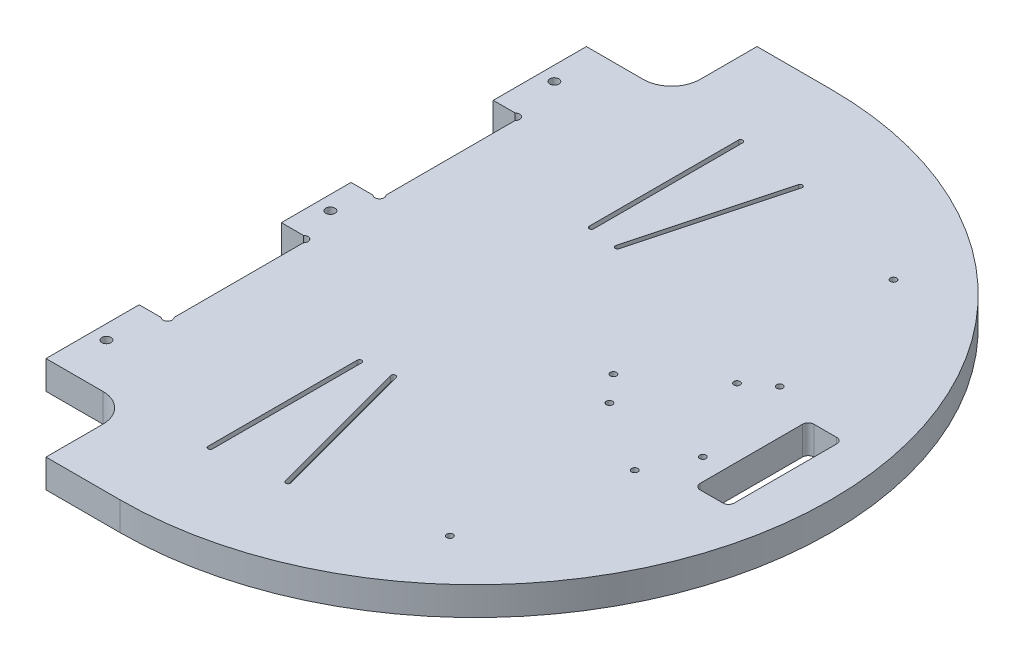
SolidWorks part; units mm, degrees
ref_plane "Plan de face" through (0, 0, 0) normal (0, 0, 1) x (1, 0, 0)
ref_plane "Plan de dessus" through (0, 0, 0) normal (0, 1, 0) x (1, 0, 0)
ref_plane "Plan de droite" through (0, 0, 0) normal (1, 0, 0) x (0, 0, -1)
sketch "Esquisse1" plane through (0, 0, 0) normal (0, 1, 0) x (1, 0, 0)
  line L0 (-177.9243, 0) -> (224.6136, 0) construction
  line L1 (0, -128.8397) -> (0, 232.2214) construction
  line L2 (-50, 153.4637) -> (-50, 78.8772) construction
  line L3 (-145, 153.4637) -> (-145, -16.1078) construction
  line L4 (-296.5055, -95) -> (138.0842, -95) construction
  line L5 (-296.5055, 95) -> (153.3586, 95) construction
  line L6 (-27.4378, -125) -> (224.6136, -125) construction
  line L7 (-16.4403, 125) -> (224.6136, 125) construction
  line L8 (50, 171.1415) -> (50, -128.8397) construction
  line L9 (145, 153.4637) -> (145, -16.1078) construction
  line L10 (175, 232.2214) -> (175, -16.1078) construction
  line L11 (24, 131.9546) -> (24, 83.7993) construction
  line L12 (-6, -128.8397) -> (-6, 131.9546) construction
  line L13 (4, 131.9546) -> (4, -110.0265) construction
  line L14 (50, 125) -> (24, 125)
  line L15 (-26, 125) -> (-26, 78.8772) construction
  line L16 (160, 48.2941) -> (160, -23.8465) construction
  line L17 (153, 31.3701) -> (153, -31.7101) construction
  line L18 (128.5, 48.2941) -> (128.5, -50.6855) construction
  line L19 (24, 125) -> (24, 105)
  line L20 (103.876, -28.5) -> (186.1026, -28.5) construction
  line L21 (103.876, 28.5) -> (186.1026, 28.5) construction
  line L22 (14, 30) -> (84.1937, 30) construction
  line L23 (-6, 95) -> (14, 95)
  line L24 (-1, 101.3704) -> (-1, -104.4655) construction
  line L25 (14, -30) -> (84.1937, -30) construction
  line L26 (-6, -95) -> (14, -95)
  line L27 (75, -37.25) -> (75, 59.9873) construction
  line L28 (25, 59.9873) -> (25, -37.25) construction
  line L29 (123, 22.0863) -> (123, -4.7308) construction
  line L32 (24, -125) -> (24, -105)
  line L38 (50, -125) -> (24, -125)
  line L39 (-6, 95) -> (-6, 62.25)
  line L40 (-9.0687, 78.75) -> (10.6589, 78.75) construction
  line L41 (-10.7326, -12.25) -> (8.3754, -12.25) construction
  line L42 (-9.8227, -37.25) -> (8.3754, -37.25) construction
  line L43 (4, -12.25) -> (-10.9186, -27.1686) construction
  line L44 (1.7373, 12.25) -> (-6, 12.25)
  line L45 (1.7373, 62.25) -> (-6, 62.25)
  line L46 (1.7373, -12.25) -> (-6, -12.25)
  line L47 (4, 59.9873) -> (4, 14.5127)
  line L48 (1.7373, -62.25) -> (-6, -62.25)
  line L49 (4, -14.5127) -> (4, -59.9873)
  line L50 (-6, 12.25) -> (-6, -12.25)
  line L51 (-6, -62.25) -> (-6, -95)
  line L53 (153, 28.5) -> (176.7692, 4.7308) construction
  line L54 (153, -28.5) -> (176.7692, -4.7308) construction
  line L55 (147, 24.6286) -> (147, -36.4853) construction
  line L56 (159, 24.6286) -> (159, -36.4891) construction
  line L57 (135.3648, -20) -> (161.0372, -20) construction
  line L58 (135.3648, 20) -> (161.0372, 20) construction
  line L60 (149, 20) -> (157, 20)
  line L61 (147, 18) -> (147, -18)
  line L62 (149, -20) -> (157, -20)
  line L63 (159, 18) -> (159, -18)
  arc A0 (50, -125) -> (50, 125) centre (50, 0) ccw construction
  circle A1 centre (50, 0) radius 40 construction
  arc A2 (50, -95) -> (50, 95) centre (50, 0) ccw construction
  arc A3 (-50, 95) -> (-50, -95) centre (-50, 0) ccw construction
  circle A4 centre (123, 0) radius 15.7 construction
  arc A5 (50, -125) -> (50, 125) centre (50, 0) ccw
  arc A6 (24, 105) -> (14, 95) centre (14, 105) cw
  circle A7 centre (123, 0) radius 19 construction
  circle A8 centre (123, 0) radius 22.5 construction
  circle A9 centre (123, 18.9498) radius 1.1
  arc A10 (24, -105) -> (14, -95) centre (14, -105) ccw
  arc A11 (4, -14.5127) -> (1.7373, -12.25) centre (2.8686, -13.3814) ccw
  circle A12 centre (139.411, -9.4749) radius 1.1
  arc A13 (149, 20) -> (147, 18) centre (149, 18) ccw
  arc A14 (4, -59.9873) -> (1.7373, -62.25) centre (2.8686, -61.1186) cw
  arc A15 (4, 59.9873) -> (1.7373, 62.25) centre (2.8686, 61.1186) ccw
  arc A16 (4, 14.5127) -> (1.7373, 12.25) centre (2.8686, 13.3814) cw
  arc A17 (157, 20) -> (159, 18) centre (157, 18) cw
  arc A18 (157, -20) -> (159, -18) centre (157, -18) ccw
  arc A19 (147, -18) -> (149, -20) centre (149, -18) ccw
  circle A20 centre (106.589, -9.4749) radius 1.1
  circle A25 centre (-1, 78.75) radius 1.6
  circle A26 centre (-1, -78.75) radius 1.6
  circle A27 centre (-1, 0) radius 1.6
  point P103 (24, 95)
  dimension "D21" = 28.5
  dimension "D7" = 5
  dimension "D23" = 45
  dimension "D12" = 30
  dimension "D26" = 25
  dimension "D27" = 6
  dimension "D29" = 16.25
  dimension "D30" = 20
  dimension "D14" = 15
  dimension "D19" = 7
  dimension "D11" = 10
  dimension "D32" = 2
  dimension "D33" = 24
  dimension "D1" = 95
  dimension "D2" = 95
  dimension "D3" = 50
  dimension "D4" = 95
  dimension "D5" = 50
  dimension "D6" = 125
  dimension "D8" = 125
  dimension "D9" = 95
  dimension "D10" = 10
  dimension "D13" = 50
  dimension "D15" = 20
  dimension "D16" = 12.25
  dimension "D17" = 25
  dimension "D18" = 45
  dimension "D20" = 57
  dimension "D22" = 31.5
  dimension "D24" = 60
  dimension "D25" = 50
  dimension "D28" = 12
  dimension "D31" = 40
  dimension "D34" = 52
extrude "Extrusion1" add sketch "Esquisse1" along normal blind 10
sketch "Esquisse2" plane through (0, 10, 0) normal (0, -1, 0) x (1, 0, 0)
  line L0 (0, -106.0513) -> (0, 104.9663) construction
  line L1 (182.2671, 0) -> (-148.3633, 0) construction
  line L2 (-6, 104.9663) -> (-6, -106.0513) construction
  line L3 (98.5, -14.8744) -> (98.5, 11.858) construction
  line L4 (59.7871, -39.6168) -> (73.3492, -90.2313)
  line L5 (74.8947, -89.8172) -> (61.3326, -39.2027)
  line L8 (119, 121.1649) -> (119, -122.6928) construction
  line L9 (108.9469, 78) -> (137.9776, 78) construction
  line L10 (160, -38.2847) -> (160, 18.001) construction
  line L11 (175, -73.0543) -> (175, 112.7438) construction
  line L12 (131.5, -34.9338) -> (131.5, -21.2355) construction
  line L13 (123.6909, -25.5) -> (143.5628, -25.5) construction
  line L14 (128.5, -38.2847) -> (128.5, 11.858) construction
  line L15 (123, -11.3497) -> (123, 32.5622) construction
  line L16 (150.5066, 125) -> (89.0838, 125) construction
  line L17 (50, 104.9663) -> (50, -111.0287) construction
  line L18 (42.3662, 40) -> (51.793, 40) construction
  line L19 (42.3662, 94) -> (51.793, 94) construction
  line L27 (61.3326, 39.2027) -> (74.8947, 89.8172)
  line L28 (73.3492, 90.2313) -> (59.7871, 39.6168)
  line L29 (50.8, 40.8) -> (50.8, 93.2)
  line L30 (49.2, 93.2) -> (49.2, 40.8)
  line L35 (47.4832, 93.2) -> (56.5838, 93.2) construction
  line L36 (48.2885, 40.8) -> (56.5838, 40.8) construction
  line L37 (49.2, 38.1388) -> (49.2, 97.736) construction
  line L54 (49.2, -40.8) -> (49.2, -93.2)
  line L55 (50.8, -93.2) -> (50.8, -40.8)
  line L72 (143.2, 0.8) -> (90.8, 0.8)
  line L73 (90.8, -0.8) -> (143.2, -0.8)
  line L74 (89.2027, -11.3326) -> (139.8172, -24.8947)
  line L75 (140.2313, -23.3492) -> (89.6168, -9.7871)
  line L76 (84.9338, -21.0928) -> (130.3136, -47.2928)
  line L77 (131.1136, -45.9072) -> (85.7338, -19.7072)
  line L78 (89.6168, 9.7871) -> (140.2313, 23.3492)
  line L79 (139.8172, 24.8947) -> (89.2027, 11.3326)
  line L80 (85.7338, 19.7072) -> (131.1136, 45.9072)
  line L81 (130.3136, 47.2928) -> (84.9338, 21.0928)
  line L82 (79.4156, 28.2843) -> (116.468, 65.3367)
  line L83 (115.3367, 66.468) -> (78.2843, 29.4156)
  line L84 (78.2843, -29.4156) -> (115.3367, -66.468)
  line L85 (116.468, -65.3367) -> (79.4156, -28.2843)
  line L86 (95.9072, 81.1136) -> (69.7072, 35.7338)
  line L87 (71.0928, 34.9338) -> (97.2928, 80.3136)
  line L88 (97.2928, -80.3136) -> (71.0928, -34.9338)
  line L89 (69.7072, -35.7338) -> (95.9072, -81.1136)
  arc A0 (73.3492, -90.2313) -> (74.8947, -89.8172) centre (74.1219, -90.0243) ccw
  circle A1 centre (98.5, 0) radius 1.1
  arc A2 (61.3326, -39.2027) -> (59.7871, -39.6168) centre (60.5598, -39.4098) ccw
  circle A5 centre (119, 78) radius 1.1
  circle A6 centre (119, -78) radius 1.1
  circle A7 centre (131.5, -25.5) radius 1.1
  circle A8 centre (131.5, 25.5) radius 1.1
  circle A9 centre (123, 0) radius 15.7 construction
  circle A10 centre (123, 0) radius 22.5 construction
  circle A11 centre (123, 0) radius 19 construction
  arc A21 (74.8947, 89.8172) -> (73.3492, 90.2313) centre (74.1219, 90.0243) ccw
  arc A22 (59.7871, 39.6168) -> (61.3326, 39.2027) centre (60.5598, 39.4098) ccw
  arc A23 (50.8, 93.2) -> (49.2, 93.2) centre (50, 93.2) ccw
  arc A24 (49.2, 40.8) -> (50.8, 40.8) centre (50, 40.8) ccw
  arc A33 (49.2, -93.2) -> (50.8, -93.2) centre (50, -93.2) ccw
  arc A34 (50.8, -40.8) -> (49.2, -40.8) centre (50, -40.8) ccw
  arc A51 (90.8, 0.8) -> (90.8, -0.8) centre (90.8, 0) ccw
  arc A52 (143.2, -0.8) -> (143.2, 0.8) centre (143.2, 0) ccw
  arc A53 (85.7338, -19.7072) -> (84.9338, -21.0928) centre (85.3338, -20.4) ccw
  arc A54 (139.8172, -24.8947) -> (140.2313, -23.3492) centre (140.0243, -24.1219) ccw
  arc A55 (89.6168, -9.7871) -> (89.2027, -11.3326) centre (89.4098, -10.5598) ccw
  arc A56 (130.3136, -47.2928) -> (131.1136, -45.9072) centre (130.7136, -46.6) ccw
  arc A57 (140.2313, 23.3492) -> (139.8172, 24.8947) centre (140.0243, 24.1219) ccw
  arc A58 (131.1136, 45.9072) -> (130.3136, 47.2928) centre (130.7136, 46.6) ccw
  arc A59 (89.2027, 11.3326) -> (89.6168, 9.7871) centre (89.4098, 10.5598) ccw
  arc A60 (84.9338, 21.0928) -> (85.7338, 19.7072) centre (85.3338, 20.4) ccw
  arc A61 (116.468, 65.3367) -> (115.3367, 66.468) centre (115.9023, 65.9024) ccw
  arc A62 (78.2843, 29.4156) -> (79.4156, 28.2843) centre (78.85, 28.85) ccw
  arc A63 (115.3367, -66.468) -> (116.468, -65.3367) centre (115.9024, -65.9023) ccw
  arc A64 (79.4156, -28.2843) -> (78.2843, -29.4156) centre (78.85, -28.85) ccw
  arc A65 (97.2928, 80.3136) -> (95.9072, 81.1136) centre (96.6, 80.7136) ccw
  arc A66 (69.7072, 35.7338) -> (71.0928, 34.9338) centre (70.4, 35.3338) ccw
  arc A67 (71.0928, -34.9338) -> (69.7072, -35.7338) centre (70.4, -35.3338) ccw
  arc A68 (95.9072, -81.1136) -> (97.2928, -80.3136) centre (96.6, -80.7136) ccw
  dimension "D7" = 50
  dimension "D8" = 40
  dimension "D16" = 0.8
  dimension "D3" = 31.5
  dimension "D6" = 52
  dimension "D10" = 125
  dimension "D2" = 15
  dimension "D4" = 3
  dimension "D5" = 25.5
  dimension "D9" = 54
  dimension "D11" = 47
  dimension "D17" = 0.8
  dimension "D18" = 0.8
extrude "Enlèv. mat.-Extru.1" cut sketch "Esquisse2" along normal blind 2
